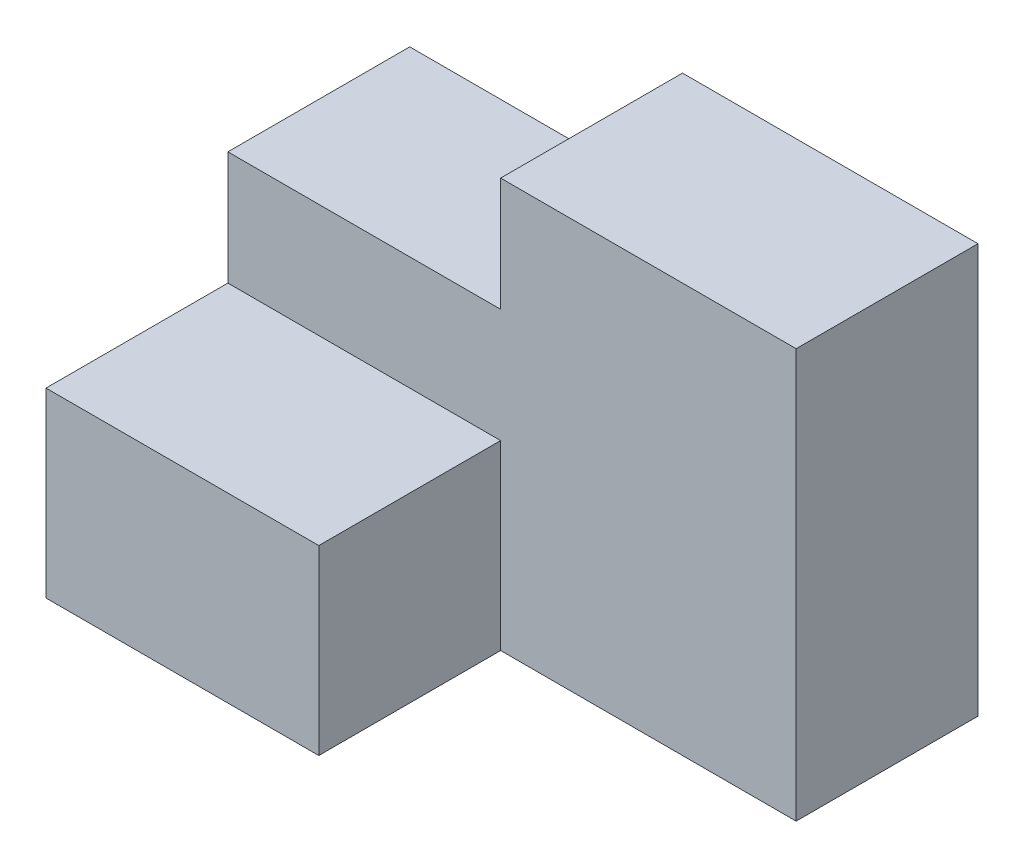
SolidWorks part; units mm, degrees
ref_plane "前视基准面" through (0, 0, 0) normal (0, 0, 1) x (1, 0, 0)
ref_plane "上视基准面" through (0, 0, 0) normal (0, 1, 0) x (1, 0, 0)
ref_plane "右视基准面" through (0, 0, 0) normal (1, 0, 0) x (0, 0, -1)
sketch "草图1" plane through (0, 0, 0) normal (0, 0, 1) x (1, 0, 0)
  line L0 (0, 52) -> (48, 52)
  line L1 (0, 0) -> (100, 0)
  line L2 (0, 0) -> (0, 52)
  line L3 (48, 72) -> (100, 72)
  line L4 (100, 0) -> (100, 72)
  line L5 (48, 52) -> (48, 72)
  dimension "D1" = 100
  dimension "D2" = 72
  dimension "D3" = 48
  dimension "D4" = 20
extrude "拉伸1" add sketch "草图1" along normal blind 32
sketch "草图2" plane through (0, 0, 32) normal (0, 0, 1) x (1, 0, 0)
  line L0 (48, 72) -> (48, 52) construction
  line L1 (0, 0) -> (48, 0)
  line L2 (0, 0) -> (0, 32)
  line L3 (0, 32) -> (48, 32)
  line L4 (48, 0) -> (48, 32)
extrude "拉伸2" add sketch "草图2" along normal blind 32
